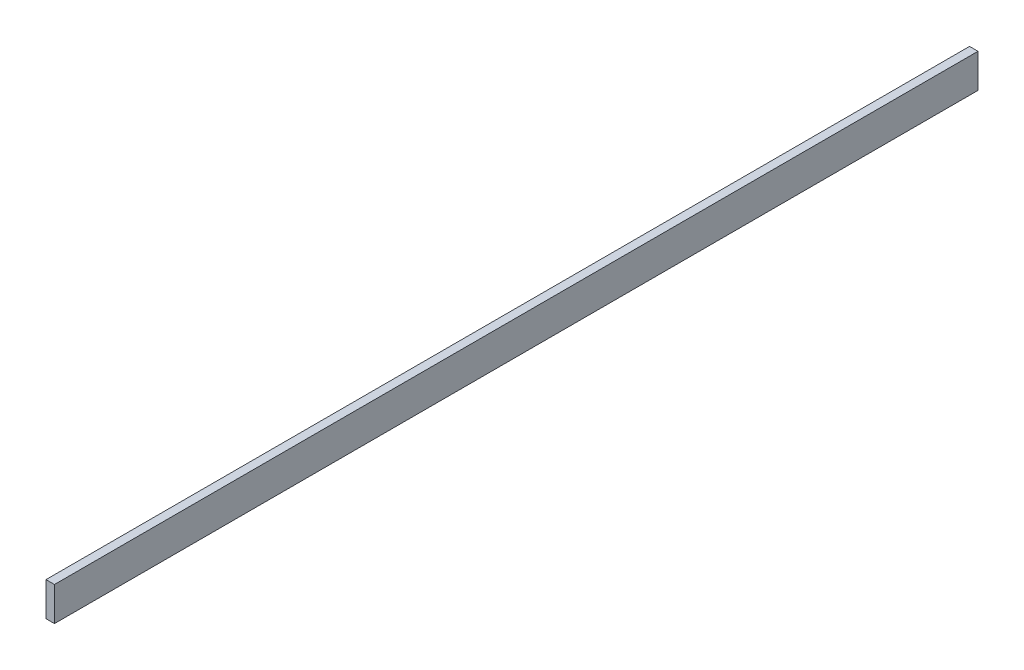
SolidWorks part; units mm, degrees
ref_plane "Plan de face" through (0, 0, 0) normal (0, 0, 1) x (1, 0, 0)
ref_plane "Plan de dessus" through (0, 0, 0) normal (0, 1, 0) x (1, 0, 0)
ref_plane "Plan de droite" through (0, 0, 0) normal (1, 0, 0) x (0, 0, -1)
sketch "Esquisse1" plane through (0, 0, 0) normal (0, 0, 1) x (1, 0, 0)
  line L1 (-2.5, 20) -> (2.5, 20)
  line L2 (-2.5, 20) -> (-2.5, 0)
  line L3 (-2.5, 0) -> (2.5, 0)
  line L4 (2.5, 20) -> (2.5, 0)
  dimension "D1" = 5
  dimension "D2" = 20
extrude "Extrusion1" add sketch "Esquisse1" along normal blind 545
